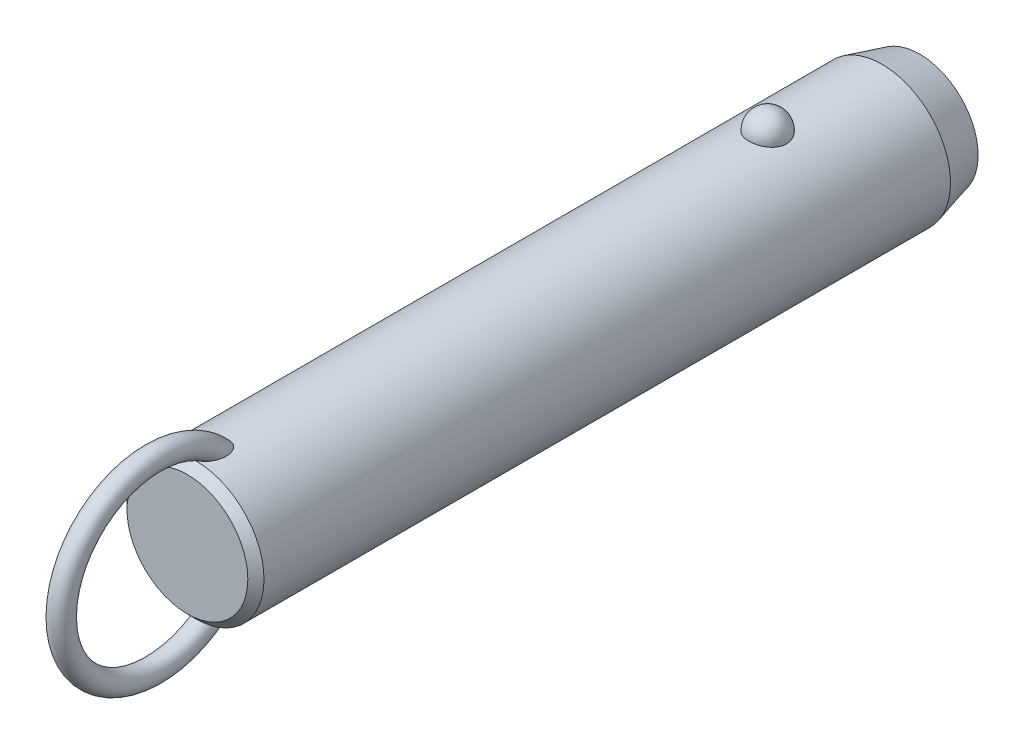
SolidWorks part; units mm, degrees
ref_plane "Front Plane" through (0, 0, 0) normal (0, 0, 1) x (1, 0, 0)
ref_plane "Top Plane" through (0, 0, 0) normal (0, 1, 0) x (1, 0, 0)
ref_plane "Right Plane" through (0, 0, 0) normal (1, 0, 0) x (0, 0, -1)
sketch "Sketch2" plane through (0, 0, 0) normal (0, 0, 1) x (1, 0, 0)
  circle A0 centre (0, 0) radius 12.7
  point P3 (0, 12.7)
  dimension "D1" = 25.4
extrude "Boss-Extrude1" add sketch "Sketch2" along normal blind 91.4
sketch "Sketch3" plane through (0, 0, 0) normal (0, 0, -1) x (-1, 0, 0)
  circle A0 centre (0, 0) radius 12.7
  dimension "D1" = 25.4
extrude "Boss-Extrude2" add sketch "Sketch3" along normal blind 31.7
chamfer "Chamfer1" distance 7 angle 15 1 edges at (-12.7, 0, -31.7)
sketch "Sketch12" plane through (0, 0, 0) normal (1, 0, 0) x (0, 0, -1)
  line L0 (-91.4, 12.7) -> (-91.4, -12.7) construction
  point P0 (-91.4, 0)
sketch "Sketch13" plane through (0, 0, 0) normal (1, 0, 0) x (0, 0, -1)
  circle A0 centre (-110.45, 0) radius 19.05
  point P2 (-91.4, 0)
  dimension "D1" = 38.1
sketch "Sketch14" plane through (0, 0, 0) normal (0, 1, 0) x (1, 0, 0)
  circle A0 centre (0, -93.4) radius 2
  point P2 (0, -91.4)
  dimension "D1" = 4
sweep "Sweep1" add profiles "Sketch14" path "Sketch13"
sketch "Sketch15" plane through (0, 0, 91.4) normal (0, 0, 1) x (1, 0, 0)
  circle A0 centre (0, 0) radius 12.7
  dimension "D1" = 25.4
extrude "Boss-Extrude3" add sketch "Sketch15" along normal blind 12.7
chamfer "Chamfer2" distance 1.5 angle 45 1 edges at (12.7, 0, 104.1)
sketch "Sketch18" plane through (0, 0, 0) normal (1, 0, 0) x (0, 0, -1)
  line L0 (24.7, 12.7) -> (-96.251, 12.7) construction
  line L1 (3.5, 16.2) -> (3.5, 9.2)
  line L2 (-96.251, -12.7) -> (24.7, -12.7) construction
  arc A0 (3.5, 16.2) -> (3.5, 9.2) centre (3.5, 12.7) ccw
  point P4 (0, 12.7)
  dimension "D1" = 28.9
revolve "Revolve1" add sketch "Sketch18" angle 360 about L1
